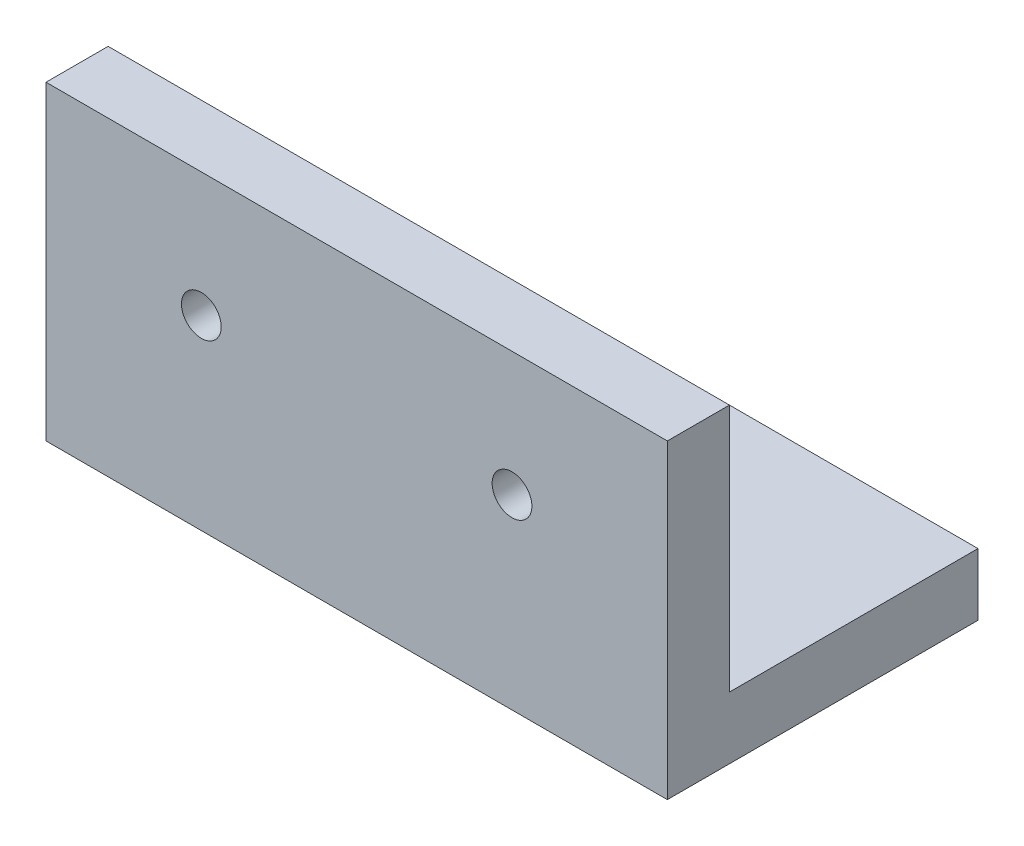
SolidWorks part; units mm, degrees
ref_plane "Piano frontale" through (0, 0, 0) normal (0, 0, 1) x (1, 0, 0)
ref_plane "Piano superiore" through (0, 0, 0) normal (0, 1, 0) x (1, 0, 0)
ref_plane "Piano destro" through (0, 0, 0) normal (1, 0, 0) x (0, 0, -1)
sketch "Sketch1" plane through (0, 0, 0) normal (0, 1, 0) x (1, 0, 0)
  line L1 (-18.5185, 0) -> (31.4815, 0)
  line L2 (-18.5185, 0) -> (-18.5185, 25)
  line L3 (-18.5185, 25) -> (31.4815, 25)
  line L4 (31.4815, 0) -> (31.4815, 25)
  dimension "D1" = 50
  dimension "D2" = 25
extrude "Boss-Extrude1" add sketch "Sketch1" along normal blind 5
sketch "Sketch2" plane through (0, 5, 0) normal (0, 1, 0) x (1, 0, 0)
  line L0 (-18.5185, 25) -> (-18.5185, 0) construction
  line L1 (31.4815, 0) -> (-18.5185, 0)
  line L2 (31.4815, 0) -> (31.4815, 5)
  line L3 (31.4815, 5) -> (-18.5185, 5)
  line L4 (-18.5185, 0) -> (-18.5185, 5)
  dimension "D1" = 5
extrude "Boss-Extrude2" add sketch "Sketch2" along normal blind 20
sketch "Sketch3" plane through (0, 5, 0) normal (0, 1, 0) x (1, 0, 0)
  line L0 (-18.5185, 25) -> (-18.5185, 5) construction
  line L1 (31.4815, 25) -> (-18.5185, 25) construction
  circle A0 centre (-6.0185, 15) radius 1.6
  dimension "D1" = 12.5
  dimension "D3" = 3.2
  dimension "D2" = 10
extrude "Cut-Extrude1" cut sketch "Sketch3" against normal through all
ref_plane "Plane1" through (6.4815, 0, 0) normal (1, 0, 0) x (0, 0, -1)
mirror "Mirror1" about plane through (6.4815, 0, 0) normal (1, 0, 0) of "Cut-Extrude1"
sketch "Sketch4" plane through (0, 0, -5) normal (0, 0, -1) x (-1, 0, 0)
  line L0 (-31.4815, 25) -> (18.5185, 25) construction
  line L1 (18.5185, 25) -> (18.5185, 5) construction
  circle A0 centre (6.0185, 15) radius 1.6
  dimension "D1" = 10
  dimension "D2" = 12.5
  dimension "D3" = 3.2
extrude "Cut-Extrude2" cut sketch "Sketch4" against normal through all
mirror "Mirror2" about plane through (6.4815, 0, 0) normal (1, 0, 0) of "Cut-Extrude2"
